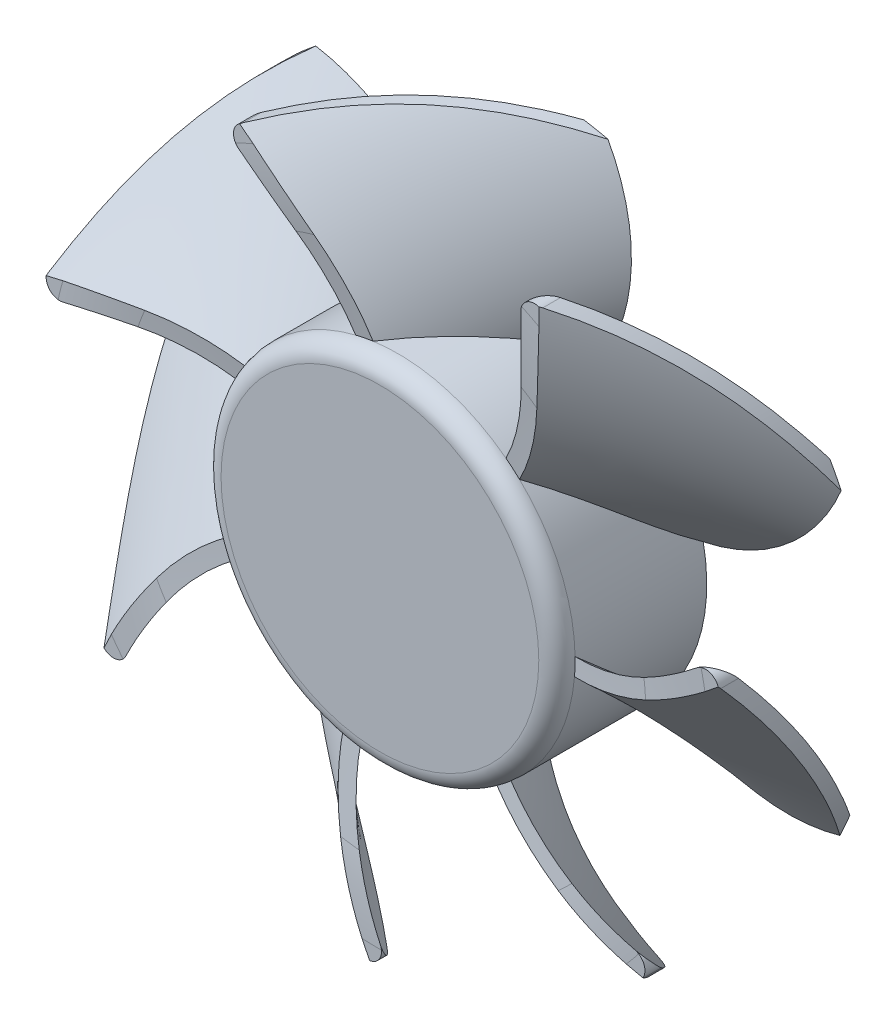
SolidWorks part; units mm, degrees
ref_plane "Plan de face" through (0, 0, 0) normal (0, 0, 1) x (1, 0, 0)
ref_plane "Plan de dessus" through (0, 0, 0) normal (0, 1, 0) x (1, 0, 0)
ref_plane "Plan de droite" through (0, 0, 0) normal (1, 0, 0) x (0, 0, -1)
imported_body "Cut-Extrude2"
sketch "草图1" plane through (0, 0, 18.0428) normal (0, 0, 1) x (1, 0, 0)
  circle A0 centre (0, 0) radius 43.5124
extrude "切除-拉伸1" cut sketch "草图1" against normal up to surface (22.1812 mm away) flip side to cut
sketch "草图2" plane through (-45.5128, 0, 0) normal (-1, 0, 0) x (0, 0, 1)
  line L1 (-2.4322, -50.6137) -> (-39.6947, -50.6137)
  line L2 (-2.4322, -50.6137) -> (-2.4322, 50.6719)
  line L3 (-2.4322, 50.6719) -> (-39.6947, 50.6719)
  line L4 (-39.6947, -50.6137) -> (-39.6947, 50.6719)
  line L5 (18.0428, 45.5215) -> (51.2272, 45.5215)
  line L6 (18.0428, 45.5215) -> (18.0428, -64.1833)
  line L7 (18.0428, -64.1833) -> (51.2272, -64.1833)
  line L8 (51.2272, 45.5215) -> (51.2272, -64.1833)
extrude "切除-拉伸2" cut sketch "草图2" against normal through all
